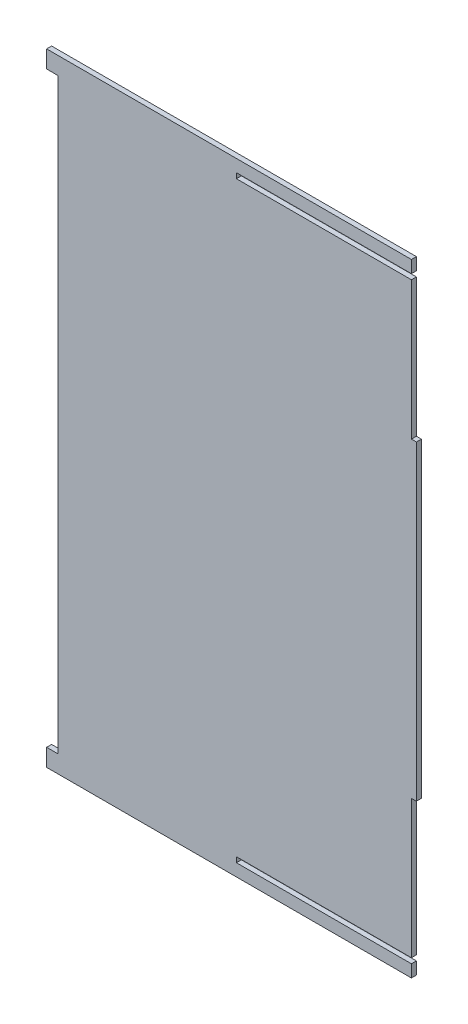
SolidWorks part; units mm, degrees
ref_plane "Спереди" through (0, 0, 0) normal (0, 0, 1) x (1, 0, 0)
ref_plane "Сверху" through (0, 0, 0) normal (0, 1, 0) x (1, 0, 0)
ref_plane "Справа" through (0, 0, 0) normal (1, 0, 0) x (0, 0, -1)
sketch "Model" plane through (0, 0, 0) normal (0, 0, 1) x (1, 0, 0)
  line L0 (-2112.0287, -320.2575) -> (-2112.0287, -431.1574)
  line L1 (-2112.0287, -431.1574) -> (-2108.0287, -431.1574)
  line L2 (-2108.0287, -431.1574) -> (-2108.0287, -681.1574)
  line L3 (-2108.0287, -681.1574) -> (-2112.0287, -681.1574)
  line L4 (-2112.0287, -681.1574) -> (-2112.0287, -792.0574)
  line L5 (-2112.0287, -792.0574) -> (-2252.6512, -792.0574)
  line L6 (-2252.6512, -792.0574) -> (-2252.6512, -792.1574)
  line L7 (-2252.6512, -792.1574) -> (-2252.6512, -796.1574)
  line L8 (-2252.6512, -796.1574) -> (-2252.6512, -796.2574)
  line L9 (-2252.6512, -796.2574) -> (-2112.0287, -796.2574)
  line L10 (-2112.0287, -796.2574) -> (-2112.0287, -806.1574)
  line L11 (-2112.0287, -806.1574) -> (-2405.1329, -806.1574)
  line L12 (-2405.1329, -806.1574) -> (-2405.1329, -792.1574)
  line L13 (-2405.1329, -792.1574) -> (-2396.0286, -792.1574)
  line L14 (-2396.0286, -792.1574) -> (-2396.0286, -320.1574)
  line L15 (-2396.0286, -320.1574) -> (-2405.1329, -320.1574)
  line L16 (-2405.1329, -320.1574) -> (-2405.1329, -306.1574)
  line L17 (-2405.1329, -306.1574) -> (-2112.0287, -306.1574)
  line L18 (-2112.0287, -306.1574) -> (-2112.0287, -316.0575)
  line L19 (-2112.0287, -316.0575) -> (-2252.6512, -316.0575)
  line L20 (-2252.6512, -316.0575) -> (-2252.6512, -316.1574)
  line L21 (-2252.6512, -316.1574) -> (-2252.6512, -320.1574)
  line L22 (-2252.6512, -320.1574) -> (-2252.6512, -320.2575)
  line L23 (-2252.6512, -320.2575) -> (-2112.0287, -320.2575)
extrude "Бобышка-Вытянуть1" add sketch "Model" along normal blind 4 contours L0 L1 L2 L3 L4 L5 L6 L7 L8 L9 L10 L11 L12 L13 L14 L15 L16 L17 L18 L19 L20 L21 L22 L23
